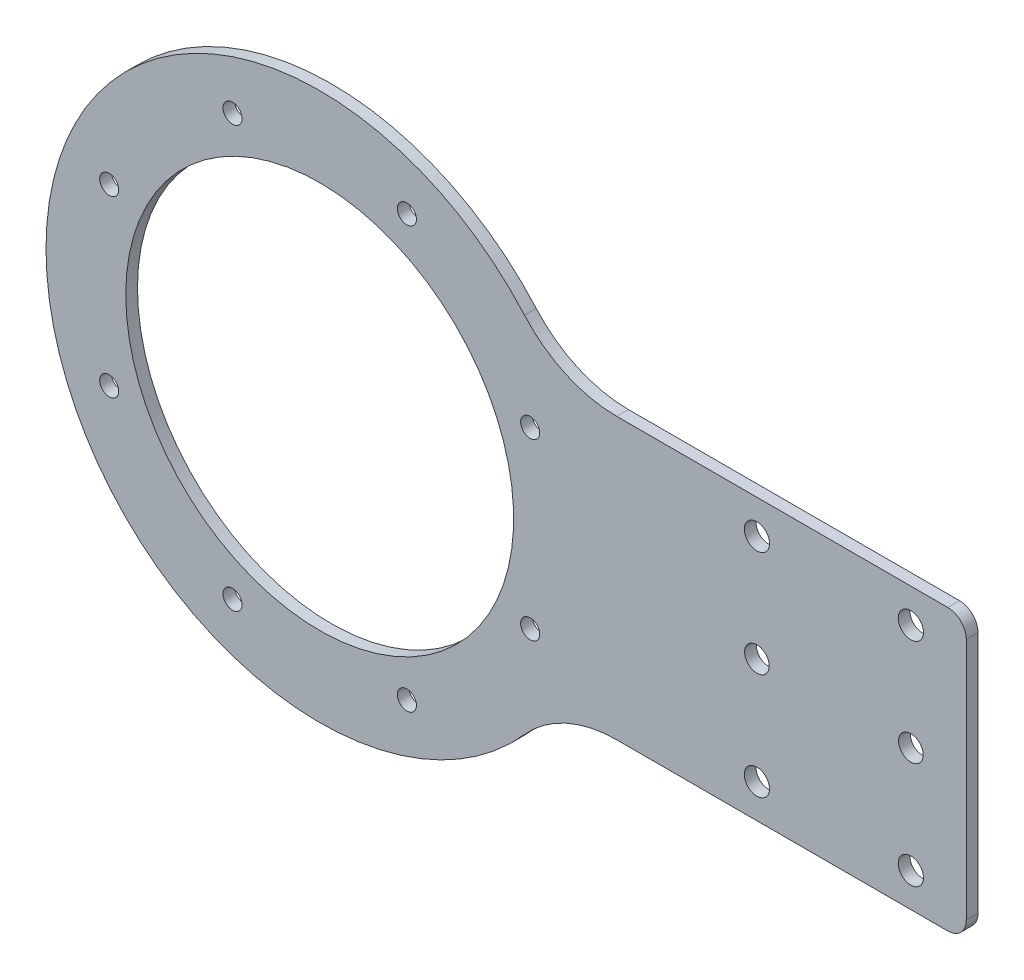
SolidWorks part; units mm, degrees
ref_plane "Front Plane" through (0, 0, 0) normal (1, 0, 0) x (0, 1, 0)
ref_plane "Top Plane" through (0, 0, 0) normal (0, 0, 1) x (0, 1, 0)
ref_plane "Right Plane" through (0, 0, 0) normal (0, 1, 0) x (-1, 0, 0)
sketch "Sketch1" plane through (0, 0, 0) normal (0, 0, 1) x (0, 1, 0)
  line L2 (-22.75, -38.1869) -> (-22.75, -105)
  line L5 (-34.1835, 14.1593) -> (0, 0) construction
  line L9 (17.25, -71) -> (17.25, -96) construction
  line L10 (-22.75, -105) -> (22.75, -105)
  line L11 (22.75, -38.1869) -> (22.75, -105)
  line L12 (0, 0) -> (-31.5, 0) construction
  line L13 (17.25, -96) -> (-17.25, -96) construction
  arc A1 (22.75, -38.1869) -> (-22.75, -38.1869) centre (0, 0) ccw
  circle A6 centre (0, 0) radius 31.5
  circle A7 centre (-34.1835, 14.1593) radius 1.55
  circle A8 centre (-14.1593, 34.1835) radius 1.55
  circle A9 centre (14.1593, 34.1835) radius 1.55
  circle A10 centre (34.1835, 14.1593) radius 1.55
  circle A11 centre (34.1835, -14.1593) radius 1.55
  circle A12 centre (14.1593, -34.1835) radius 1.55
  circle A13 centre (-14.1593, -34.1835) radius 1.55
  circle A14 centre (-34.1835, -14.1593) radius 1.55
  circle A32 centre (-17.25, -96) radius 2.05
  circle A33 centre (17.25, -96) radius 2.05
  circle A34 centre (-17.25, -71) radius 2.05
  circle A35 centre (17.25, -71) radius 2.05
  point P10 (0, -105)
  point P35 (0, -96)
  dimension "D2" = 88.9
  dimension "D5" = 34.5
  dimension "D6" = 4.1
  dimension "D7" = 63
  dimension "D8" = 3.1
  dimension "D4" = 25
  dimension "D13" = 9
  dimension "D3" = 105
  dimension "D9" = 37
  dimension "D11" = 22.5
  dimension "D12" = 45.5
  dimension "D10" = 8
extrude "Boss-Extrude1" add sketch "Sketch1" along normal blind 1.905
fillet "Fillet1" radius 20 2 edges at (38.1869, 22.75, 0.9525) (38.1869, -22.75, 0.9525)
fillet "Fillet2" radius 3 2 edges at (105, 22.75, 0.9525) (105, -22.75, 0.9525)
sketch "Sketch2" plane through (0, 0, 1.905) normal (0, 0, 1) x (1, 0, 0)
  line L0 (71, 17.25) -> (71, -17.25) construction
  line L1 (96, 17.25) -> (96, -17.25) construction
  circle A0 centre (71, 0) radius 2
  circle A1 centre (96, 0) radius 2
  dimension "D1" = 4
extrude "Cut-Extrude1" cut sketch "Sketch2" against normal through all
